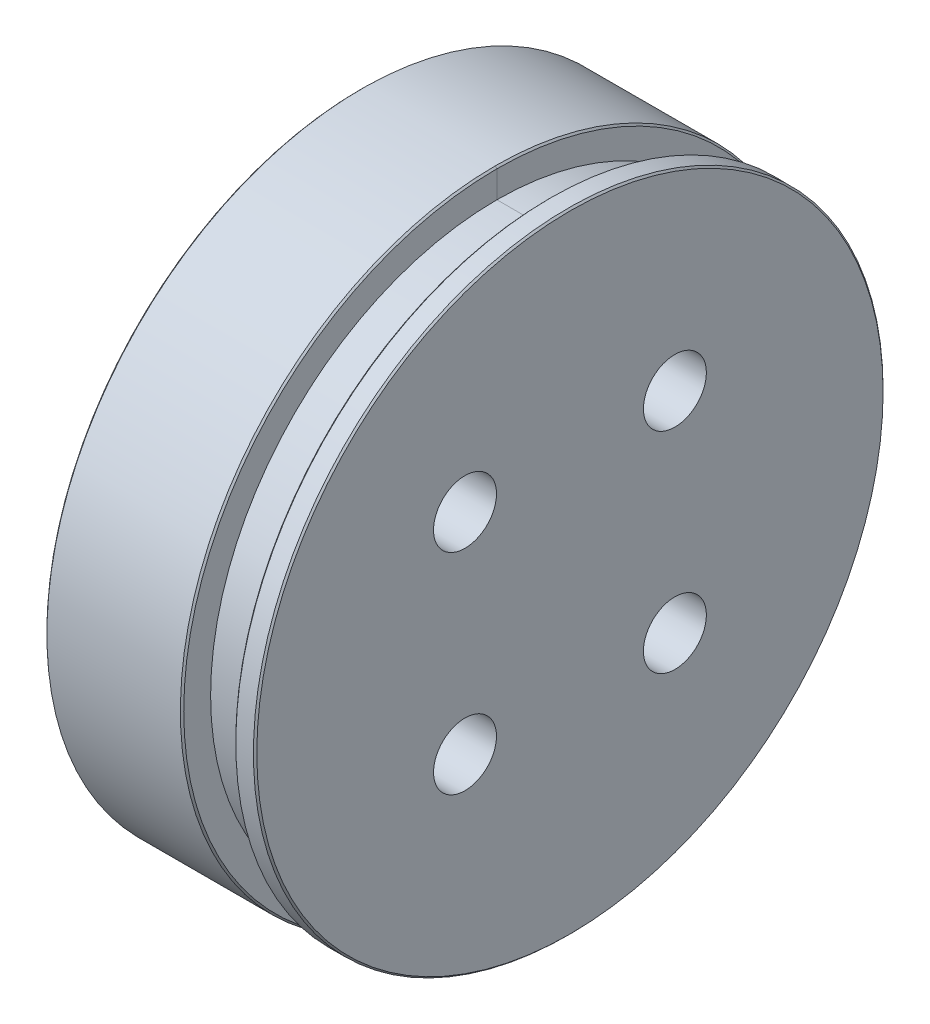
SolidWorks part; units mm, degrees
ref_plane "Front Plane" through (0, 0, 0) normal (0, 0, 1) x (1, 0, 0)
ref_plane "Top Plane" through (0, 0, 0) normal (0, 1, 0) x (1, 0, 0)
ref_plane "Right Plane" through (0, 0, 0) normal (1, 0, 0) x (0, 0, -1)
sketch "Sketch1" plane through (0, 0, 0) normal (1, 0, 0) x (0, 0, -1)
  circle A0 centre (0, 0) radius 47.625
  dimension "D1" = 95.25
extrude "Boss-Extrude1" add sketch "Sketch1" against normal blind 31.75
sketch "Sketch6" plane through (-31.75, 0, 0) normal (-1, 0, 0) x (0, 0, 1)
  circle A0 centre (0, 0) radius 38.1
  circle A1 centre (26.9408, 26.9408) radius 3.9687
  circle A2 centre (0, 38.1) radius 3.9688
  circle A3 centre (38.1, 0) radius 3.9687
  circle A4 centre (0, -38.1) radius 3.9688
  circle A5 centre (-38.1, 0) radius 3.9687
  circle A6 centre (38.1, 0) radius 3.9687
  circle A7 centre (26.9408, -26.9408) radius 3.9687
  circle A8 centre (0, -38.1) radius 3.9688
  circle A9 centre (-26.9408, -26.9408) radius 3.9688
  circle A10 centre (-38.1, 0) radius 3.9687
  circle A11 centre (-26.9408, 26.9408) radius 3.9688
  point P27 (0, 0)
  dimension "D1" = 76.2
  dimension "D2" = 7.9375
  dimension "D3" = 8
extrude "Cut-Extrude3" cut sketch "Sketch6" against normal blind 15.875 contours A11 | A2 | A1 | A3 | A7 | A4 | A9 | A5
sketch "Sketch7" plane through (0, 0, 0) normal (1, 0, 0) x (0, 0, -1)
  line L1 (-15.875, -15.875) -> (15.875, -15.875)
  line L2 (-15.875, -15.875) -> (-15.875, 15.875)
  line L3 (-15.875, 15.875) -> (15.875, 15.875)
  line L4 (15.875, -15.875) -> (15.875, 15.875)
  line L5 (-15.875, -15.875) -> (15.875, 15.875) construction
  line L6 (-15.875, 15.875) -> (15.875, -15.875) construction
  circle A0 centre (15.875, 15.875) radius 4.7625
  circle A1 centre (-15.875, 15.875) radius 4.7625
  circle A2 centre (-15.875, -15.875) radius 4.7625
  circle A3 centre (15.875, -15.875) radius 4.7625
  point P0 (0, 0)
  dimension "D3" = 9.525
  dimension "D1" = 31.75
  dimension "D2" = 31.75
extrude "Cut-Extrude4" cut sketch "Sketch7" against normal through all contours A1 | A0 | A3 | A2
sketch "Sketch8" plane through (0, 0, 0) normal (0, 0, 1) x (1, 0, 0)
  line L2 (0, 47.625) -> (-31.75, 47.625) construction
  line L3 (-3.175, 47.625) -> (-11.049, 47.625)
  line L4 (-3.175, 47.625) -> (-3.175, 43.307)
  line L5 (-3.175, 43.307) -> (-11.049, 43.307)
  line L6 (-11.049, 47.625) -> (-11.049, 43.307)
  line L7 (0, -47.625) -> (0, 47.625) construction
  dimension "D1" = 7.874
  dimension "D2" = 4.318
  dimension "D3" = 3.175
sweep "Cut-Sweep1" cut profiles "Sketch8"
chamfer "Chamfer2" distance 0.254 angle 45 6 edges at (-31.75, 0, -47.625) (-3.175, 33.676, -33.676) (-3.175, -33.676, 33.676) (0, 0, -47.625) (-11.049, 33.676, -33.676) (-11.049, -33.676, 33.676)
